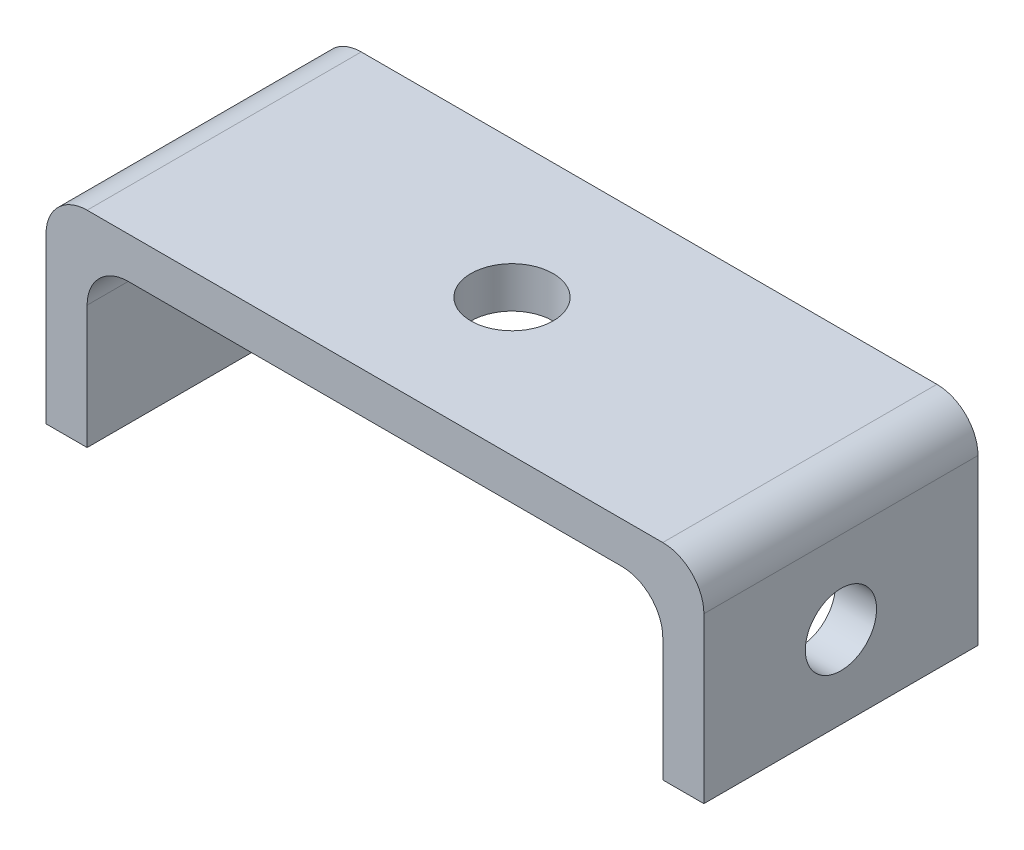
SolidWorks part; units mm, degrees
ref_plane "Plan de face" through (0, 0, 0) normal (0, 0, 1) x (1, 0, 0)
ref_plane "Plan de dessus" through (0, 0, 0) normal (0, 1, 0) x (1, 0, 0)
ref_plane "Plan de droite" through (0, 0, 0) normal (1, 0, 0) x (0, 0, -1)
sketch "Esquisse1" plane through (0, 0, 0) normal (0, 0, 1) x (1, 0, 0)
  line L0 (-51.8844, 29.6482) -> (-3.8844, 29.6482)
  line L1 (-51.8844, 14.6482) -> (-51.8844, 29.6482)
  line L2 (-3.8844, 29.6482) -> (-3.8844, 14.6482)
  line L3 (-48.8844, 26.6482) -> (-6.8844, 26.6482)
  line L4 (-51.8844, 14.6482) -> (-48.8844, 14.6482)
  line L8 (-48.8844, 26.6482) -> (-48.8844, 14.6482)
  line L11 (-3.8844, 14.6482) -> (-6.8844, 14.6482)
  line L12 (-6.8844, 26.6482) -> (-6.8844, 14.6482)
  dimension "D1" = 48
  dimension "D3" = 15
  dimension "D4" = 3
  dimension "D5" = 3
extrude "Extrusion1" add sketch "Esquisse1" along normal blind 20
fillet "Congé1" radius 3 4 edges at (-51.8844, 29.6482, 10) (-3.8844, 29.6482, 10) (-6.8844, 26.6482, 10) (-48.8844, 26.6482, 10)
sketch "Esquisse2" plane through (-51.8844, 0, 0) normal (-1, 0, 0) x (0, 0, 1)
  line L0 (20, 14.6482) -> (0, 14.6482) construction
  line L1 (0, 26.6482) -> (0, 14.6482) construction
  circle A0 centre (10, 20.6482) radius 2.6
  dimension "D1" = 6
  dimension "D2" = 10
  dimension "D3" = 5.2
extrude "Enlèv. mat.-Extru.1" cut sketch "Esquisse2" against normal through all
sketch "Esquisse3" plane through (0, 26.6482, 0) normal (0, -1, 0) x (1, 0, 0)
  line L4 (-45.8844, 20) -> (-9.8844, 20) construction
  line L7 (-45.8844, 20) -> (-45.8844, 0) construction
  circle A0 centre (-27.8844, 10) radius 3
  dimension "D1" = 6
  dimension "D2" = 10
  dimension "D3" = 18
extrude "Enlèv. mat.-Extru.2" cut sketch "Esquisse3" against normal through all
